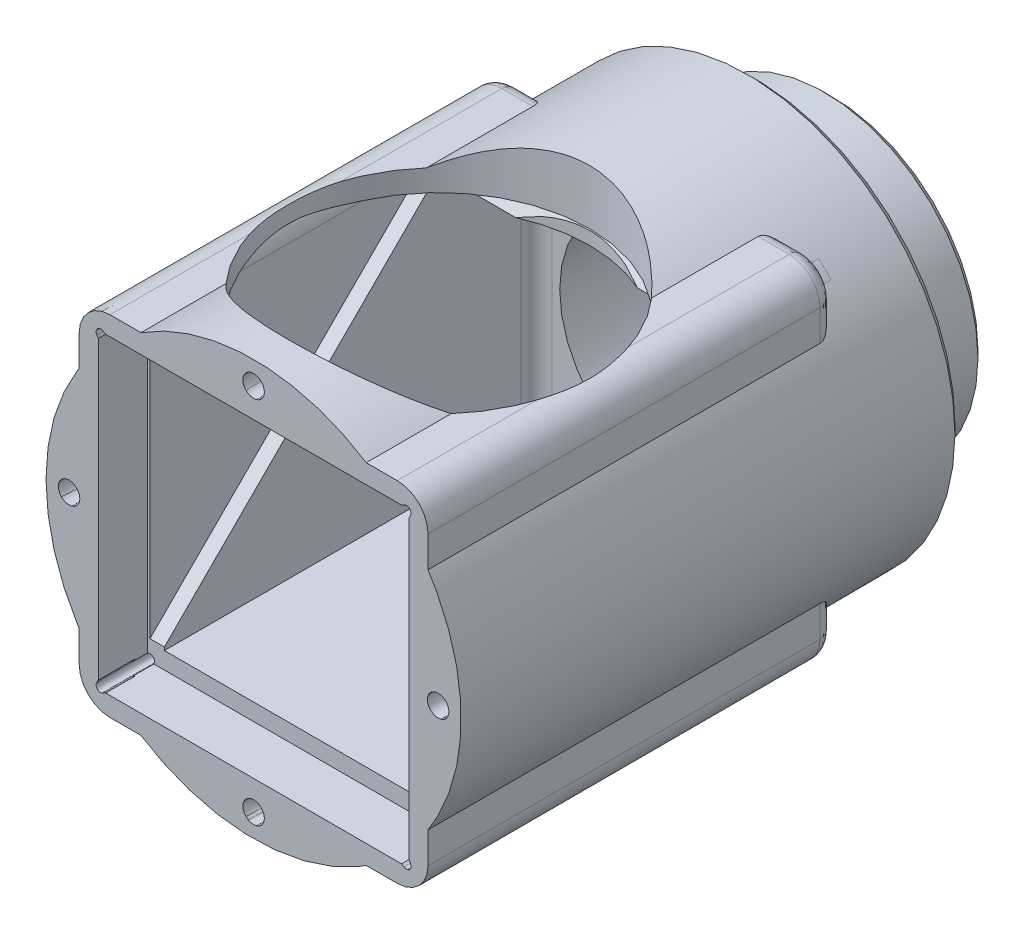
SolidWorks part; units mm, degrees
ref_plane "Front Plane" through (0, 0, 0) normal (0, 0, 1) x (1, 0, 0)
ref_plane "Top Plane" through (0, 0, 0) normal (0, 1, 0) x (1, 0, 0)
ref_plane "Right Plane" through (0, 0, 0) normal (1, 0, 0) x (0, 0, -1)
sketch "Sketch1" plane through (0, 0, 0) normal (0, 0, 1) x (1, 0, 0)
  circle A0 centre (0, 0) radius 12.7
  dimension "D1" = 25.4
extrude "Boss-Extrude1" add sketch "Sketch1" along normal blind 6.35
sketch "Sketch2" plane through (0, 0, 6.35) normal (0, 0, 1) x (1, 0, 0)
  circle A0 centre (0, 0) radius 17.145
  dimension "D1" = 34.29
extrude "Boss-Extrude2" add sketch "Sketch2" along normal blind 44.45
sketch "Sketch3" plane through (0, 0, 50.8) normal (0, 0, 1) x (1, 0, 0)
  circle A0 centre (0, 0) radius 12.5
  dimension "D1" = 25
extrude "Cut-Extrude1" cut sketch "Sketch3" against normal blind 31.75
ref_plane "Plane1" through (0, 25.4, 0) normal (0, 1, 0) x (1, 0, 0)
sketch "Sketch5" plane through (0, 0, 50.8) normal (0, 0, 1) x (1, 0, 0)
  line L1 (-12.625, 12.625) -> (12.625, 12.625)
  line L2 (-12.625, 12.625) -> (-12.625, -12.625)
  line L3 (-12.625, -12.625) -> (12.625, -12.625)
  line L4 (12.625, 12.625) -> (12.625, -12.625)
  line L5 (-12.625, 12.625) -> (12.625, -12.625) construction
  line L6 (-12.625, -12.625) -> (12.625, 12.625) construction
  point P0 (0, 0)
  dimension "D1" = 25.25
  dimension "D2" = 25.25
extrude "Cut-Extrude3" cut sketch "Sketch5" against normal blind 38.1
sketch "Sketch11" plane through (0, 0, 50.8) normal (0, 0, 1) x (1, 0, 0)
  circle A0 centre (0, 0) radius 17.145
extrude "Cut-Extrude5" cut sketch "Sketch11" against normal blind 3.048
sketch "Sketch10" plane through (12.625, 0, 0) normal (-1, 0, 0) x (0, 0, 1)
  line L0 (19.887, 12.625) -> (45.137, -12.625)
  line L1 (12.7, 12.625) -> (47.752, 12.625) construction
  line L2 (47.752, -12.625) -> (12.7, -12.625) construction
  line L3 (45.137, -12.625) -> (18.8617, -12.625)
  line L5 (19.887, 12.625) -> (12.7, 12.625)
  line L6 (12.7, 12.625) -> (12.7, -12.625)
  line L7 (12.7, -12.625) -> (45.137, -12.625)
  point P6 (32.512, 0)
  dimension "D1" = 32.512
  dimension "D2" = 45
extrude "Boss-Extrude4" add sketch "Sketch10" along normal up to surface (25.25 mm away) contours L0 M8 M9 M10 | L5 L6 L0 M8 | L6 L7 L3 L0 M10
sketch "Sketch4" plane through (0, 25.4, 0) normal (0, 1, 0) x (1, 0, 0)
  circle A0 centre (0, -32.4612) radius 12.446
  dimension "D1" = 24.892
  dimension "D2" = 32.4612
extrude "Cut-Extrude2" cut sketch "Sketch4" against normal blind 17.2572
sketch "Sketch12" plane through (0, 0, 47.752) normal (0, 0, 1) x (1, 0, 0)
  line L0 (-11.6, 12.625) -> (11.6, 12.625) construction
  line L1 (-14.403, 14.403) -> (14.403, 14.403)
  line L2 (-14.403, 14.403) -> (-14.403, -14.403)
  line L3 (-14.403, -14.403) -> (14.403, -14.403)
  line L4 (14.403, 14.403) -> (14.403, -14.403)
  line L5 (-14.403, 14.403) -> (14.403, -14.403) construction
  line L6 (-14.403, -14.403) -> (14.403, 14.403) construction
  line L8 (-12.625, -12.625) -> (12.625, -12.625)
  line L9 (-12.625, -12.625) -> (-12.625, 12.625)
  line L10 (-12.625, 12.625) -> (12.625, 12.625)
  line L11 (12.625, -12.625) -> (12.625, 12.625)
  line L12 (-12.625, -12.625) -> (12.625, 12.625) construction
  line L13 (-12.625, 12.625) -> (12.625, -12.625) construction
  point P0 (0, 0)
  point P8 (0, 0)
  dimension "D1" = 1.778
  dimension "D2" = 1.778
extrude "Boss-Extrude5" add sketch "Sketch12" against normal blind 33.6318
fillet "Fillet3" radius 2.54 4 edges at (-14.403, -14.403, 30.9361) (14.403, -14.403, 30.9361) (14.403, 14.403, 30.9361) (-14.403, 14.403, 30.9361)
sketch "Sketch6" plane through (0, 0, 0) normal (0, 0, -1) x (-1, 0, 0)
  circle A0 centre (0, 0) radius 9.525
  dimension "D1" = 19.05
combine bodies "Combine1" operation type add bodies to combine 125 121
sketch "Sketch14" plane through (0, 14.403, 0) normal (0, 1, 0) x (1, 0, 0)
  circle A0 centre (0, -32.4612) radius 12.446
  dimension "D2" = 24.892
  dimension "D1" = 32.4612
extrude "Cut-Extrude7" cut sketch "Sketch14" against normal up to surface (1.778 mm away)
extrude "Cut-Extrude8" cut sketch "Sketch6" against normal blind 72.644
sketch "Sketch15" plane through (0, 0, 47.752) normal (0, 0, 1) x (1, 0, 0)
  line L9 (-11.43, 11.43) -> (11.43, 11.43)
  line L10 (-11.43, 11.43) -> (-11.43, -11.43)
  line L11 (-11.43, -11.43) -> (11.43, -11.43)
  line L12 (11.43, 11.43) -> (11.43, -11.43)
  line L13 (-11.43, 11.43) -> (11.43, -11.43) construction
  line L14 (-11.43, -11.43) -> (11.43, 11.43) construction
  point P0 (0, 0)
  dimension "D1" = 22.86
  dimension "D2" = 22.86
extrude "Cut-Extrude9" cut sketch "Sketch15" against normal blind 34.798
fillet "Fillet6" radius 1.27 4 edges at (11.43, 0, 12.954) (0, -11.43, 12.954) (-11.43, 0, 12.954) (0, 11.43, 12.954)
chamfer "Chamfer1" distance 0.635 angle 45 2 edges at (17.145, 0, 6.35) (12.7, 0, 0)
fillet "Fillet7" radius 1.27 12 edges at (10.5819, 14.403, 14.1202) (14.403, 10.5819, 14.1202) (13.6591, 13.6591, 14.1202) (14.403, -10.5819, 14.1202) (10.5819, -14.403, 14.1202) (-10.5819, -14.403, 14.1202) (-14.403, -10.5819, 14.1202) (-14.403, 10.5819, 14.1202) (-10.5819, 14.403, 14.1202) (13.6591, -13.6591, 14.1202) (-13.6591, -13.6591, 14.1202) (-13.6591, 13.6591, 14.1202)
sketch "Sketch16" plane through (0, 0, 47.752) normal (0, 0, 1) x (1, 0, 0)
  circle A0 centre (12.625, 12.625) radius 0.381
  dimension "D1" = 0.762
extrude "Cut-Extrude10" cut sketch "Sketch16" against normal blind 30.48
pattern_circular "CirPattern1" count 4 over 360 about axis through (0, 0, 0) along (0, 0, 1) of "Cut-Extrude10"
fillet "Fillet8" radius 1.905 10 edges at (-12.244, -12.625, 46.4445) (-12.625, -12.244, 46.254) (12.244, -12.625, 46.4445) (12.625, -12.244, 46.254) (12.625, 12.244, 34.01) (12.244, 12.625, 41.2232) (12.244, 12.625, 25.0575) (-12.244, 12.625, 25.0575) (-12.244, 12.625, 41.2232) (-12.625, 12.244, 34.01)
sketch "Sketch17" plane through (0, 0, 47.752) normal (0, 0, 1) x (1, 0, 0)
  line L1 (-12.827, 12.827) -> (12.827, 12.827)
  line L2 (-12.827, 12.827) -> (-12.827, -12.827)
  line L3 (-12.827, -12.827) -> (12.827, -12.827)
  line L4 (12.827, 12.827) -> (12.827, -12.827)
  line L5 (-12.827, 12.827) -> (12.827, -12.827) construction
  line L6 (-12.827, -12.827) -> (12.827, 12.827) construction
  point P0 (0, 0)
  dimension "D1" = 25.654
  dimension "D2" = 25.654
extrude "Cut-Extrude11" cut sketch "Sketch17" against normal blind 4.064
hole_wizard "#2-56 Tapped Hole1" positions "Sketch18" profile "Sketch19" tap size "#2-56" standard "ANSI Inch"
sketch "Sketch18" plane through (0, 0, 47.752) normal (0, 0, 1) x (1, 0, 0)
  point P0 (0, 15.24)
  point P6 (0, -15.24)
  point P8 (15.24, 0)
  point P10 (-15.24, 0)
  dimension "D1" = 15.24
  dimension "D2" = 15.24
  dimension "D3" = 15.24
  dimension "D4" = 15.24
sketch "Sketch19" plane through (0, 15.24, 47.752) normal (1, 0, 0) x (0, -1, 0)
  line L0 (0, 0) -> (0, 13.2342)
  line L1 (0, 13.2342) -> (0.889, 12.7)
  line L2 (0.889, 12.7) -> (0.889, 0)
  line L5 (0.889, 0) -> (0, 0)
  line L10 (0, 13.2342) -> (-0.889, 12.7) construction
  line L11 (0, -6.35) -> (0, 107.95) construction
  dimension "Tap Drill Dia." = 1.778
  dimension "Tap Drill Depth" = 12.7
  dimension "Drill Angle" = 118
fillet "Fillet9" radius 7.62 4 edges at (12.625, 12.625, 13.4101) (12.625, -12.625, 13.4101) (-12.625, -12.625, 13.4101) (-12.625, 12.625, 13.4101)
